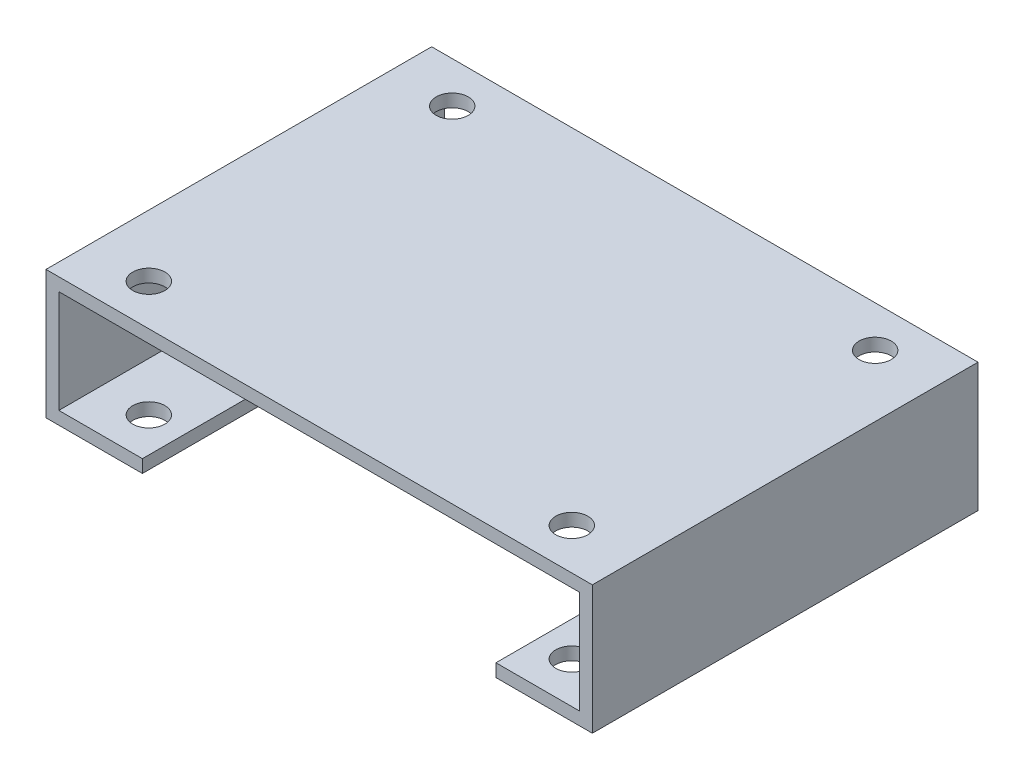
SolidWorks part; units mm, degrees
ref_plane "Front Plane" through (0, 0, 0) normal (0, 0, 1) x (1, 0, 0)
ref_plane "Top Plane" through (0, 0, 0) normal (0, 1, 0) x (1, 0, 0)
ref_plane "Right Plane" through (0, 0, 0) normal (1, 0, 0) x (0, 0, -1)
sketch "Sketch1" plane through (0, 0, 0) normal (0, 0, 1) x (1, 0, 0)
  line L0 (-34.925, 0) -> (-53.975, 0)
  line L1 (-53.975, 0) -> (-53.975, 25.4)
  line L2 (-53.975, 25.4) -> (53.975, 25.4)
  line L3 (53.975, 25.4) -> (53.975, 0)
  line L4 (53.975, 0) -> (34.925, 0)
  line L5 (0, 0) -> (0, 25.4) construction
  dimension "D1" = 107.95
  dimension "D2" = 25.4
  dimension "D3" = 19.05
extrude "Extrude-Thin1" add sketch "Sketch1" along normal blind 76.2 thin
sketch "Sketch2" plane through (0, 0, 0) normal (0, -1, 0) x (1, 0, 0)
  line L0 (-53.975, 0) -> (53.975, 76.2) construction
  line L1 (-41.783, 8.128) -> (41.783, 68.072) construction
  circle A0 centre (-41.783, 68.072) radius 3.175
  circle A1 centre (-41.783, 8.128) radius 3.175
  circle A2 centre (41.783, 68.072) radius 3.175
  circle A3 centre (41.783, 8.128) radius 3.175
  point P13 (0, 38.1)
  dimension "D1" = 83.566
  dimension "D2" = 59.944
  dimension "D3" = 6.35
extrude "Extrude1" cut sketch "Sketch2" against normal through all
